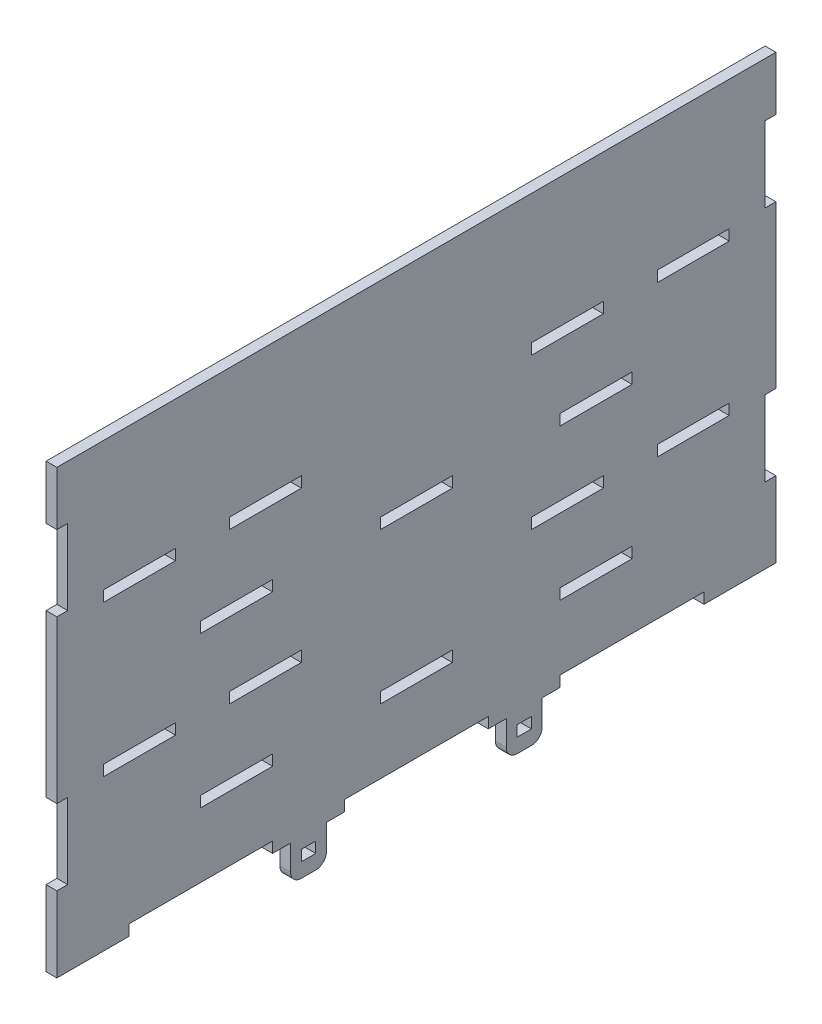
SolidWorks part; units mm, degrees
ref_plane "Front Plane" through (0, 0, 0) normal (0, 0, 1) x (1, 0, 0)
ref_plane "Top Plane" through (0, 0, 0) normal (0, 1, 0) x (1, 0, 0)
ref_plane "Right Plane" through (0, 0, 0) normal (1, 0, 0) x (0, 0, -1)
sketch "草图1" plane through (0, 0, 0) normal (1, 0, 0) x (0, 0, -1)
  line L0 (-100, 60) -> (100, 60)
  line L1 (100, 60) -> (100, -60)
  line L2 (100, -60) -> (-100, -60)
  line L3 (-100, -60) -> (-100, 60)
  point P4 (-100, 0)
  point P6 (0, 60)
  dimension "D1" = 200
  dimension "D2" = 120
extrude "凸台-拉伸1" add sketch "草图1" along normal blind 3
sketch "草图2" plane through (3, 0, 0) normal (1, 0, 0) x (0, 0, -1)
  line L0 (-100, -60) -> (-100, -63)
  line L1 (-100, -63) -> (-80, -63)
  line L2 (-80, -63) -> (-80, -60)
  line L3 (-100, -60) -> (100, -60) construction
  line L4 (-80, -60) -> (-100, -60)
  line L5 (-40, -60) -> (-40, -63)
  line L6 (-40, -63) -> (-20, -63)
  line L7 (-20, -63) -> (-20, -60)
  line L8 (-20, -60) -> (-40, -60)
  line L9 (20, -60) -> (20, -63)
  line L10 (20, -63) -> (40, -63)
  line L11 (40, -63) -> (40, -60)
  line L12 (40, -60) -> (20, -60)
  line L13 (80, -60) -> (80, -63)
  line L14 (80, -63) -> (100, -63)
  line L15 (100, -63) -> (100, -60)
  line L16 (100, -60) -> (80, -60)
  line L22 (100, -60) -> (100, 60) construction
  dimension "D1" = 3
  dimension "D2" = 3
  dimension "D3" = 3
  dimension "D4" = 3
  dimension "D5" = 0
  dimension "D6" = 20
  dimension "D7" = 40
  dimension "D8" = 20
  dimension "D9" = 40
  dimension "D10" = 20
  dimension "D12" = 20
extrude "凸台-拉伸3" add sketch "草图2" against normal blind 3
sketch "草图5" plane through (3, 0, 0) normal (1, 0, 0) x (0, 0, -1)
  line L0 (-100, -42) -> (100, -42) construction
  line L1 (-100, 60) -> (-100, -63) construction
  line L2 (100, -63) -> (100, 60) construction
  line L3 (-100, -21) -> (100, -21) construction
  line L4 (-100, 0) -> (100, 0) construction
  line L5 (-80, -60) -> (-40, -60) construction
  line L6 (-60, -42) -> (-60, -39)
  line L7 (-60, -39) -> (-40, -39)
  line L8 (-40, -39) -> (-40, -42)
  line L9 (-40, -42) -> (-60, -42)
  line L10 (0, 60) -> (0, -60) construction
  line L11 (100, 60) -> (-100, 60) construction
  line L12 (-20, -60) -> (20, -60) construction
  line L13 (-10, -42) -> (-10, -39)
  line L14 (-10, -39) -> (10, -39)
  line L15 (10, -39) -> (10, -42)
  line L16 (10, -42) -> (-10, -42)
  line L17 (40, -39) -> (40, -42)
  line L18 (60, -42) -> (60, -39)
  line L19 (60, -39) -> (40, -39)
  line L20 (40, -42) -> (60, -42)
  line L21 (-10, 3) -> (10, 3)
  line L22 (-40, 0) -> (-60, 0)
  line L23 (10, 3) -> (10, 0)
  line L24 (10, 0) -> (-10, 0)
  line L25 (-10, 0) -> (-10, 3)
  line L26 (40, 0) -> (60, 0)
  line L27 (-60, 0) -> (-60, 3)
  line L28 (-60, 3) -> (-40, 3)
  line L29 (40, 3) -> (40, 0)
  line L30 (60, 0) -> (60, 3)
  line L31 (60, 3) -> (40, 3)
  line L32 (-40, 3) -> (-40, 0)
  line L33 (-100, -42) -> (-97, -42)
  line L34 (-97, -42) -> (-97, -21)
  line L35 (-97, -21) -> (-100, -21)
  line L38 (-97, 45) -> (-100, 45)
  line L40 (-100, -21) -> (-100, -42)
  line L41 (-87, -21) -> (-87, -18)
  line L42 (-87, -18) -> (-67, -18)
  line L43 (-67, -18) -> (-67, -21)
  line L44 (-67, -21) -> (-87, -21)
  line L45 (-52, -18) -> (-52, -21)
  line L46 (-52, -21) -> (-32, -21)
  line L47 (-32, -21) -> (-32, -18)
  line L48 (-32, -18) -> (-52, -18)
  line L49 (97, 45) -> (100, 45)
  line L53 (97, -21) -> (100, -21)
  line L54 (97, -42) -> (97, -21)
  line L55 (100, -42) -> (97, -42)
  line L56 (100, -21) -> (100, -42)
  line L57 (32, -21) -> (32, -18)
  line L58 (52, -21) -> (32, -21)
  line L59 (52, -18) -> (52, -21)
  line L60 (32, -18) -> (52, -18)
  line L61 (67, -18) -> (67, -21)
  line L62 (87, -18) -> (67, -18)
  line L63 (87, -21) -> (87, -18)
  line L64 (67, -21) -> (87, -21)
  line L65 (52, 24) -> (52, 21)
  line L66 (-67, 21) -> (-87, 21)
  line L67 (87, 21) -> (87, 24)
  line L68 (-32, 21) -> (-32, 24)
  line L69 (-52, 24) -> (-52, 21)
  line L70 (52, 21) -> (32, 21)
  line L71 (67, 24) -> (67, 21)
  line L72 (-87, 24) -> (-67, 24)
  line L73 (-32, 24) -> (-52, 24)
  line L74 (32, 21) -> (32, 24)
  line L75 (-87, 21) -> (-87, 24)
  line L76 (-52, 21) -> (-32, 21)
  line L77 (32, 24) -> (52, 24)
  line L78 (87, 24) -> (67, 24)
  line L79 (67, 21) -> (87, 21)
  line L80 (-67, 24) -> (-67, 21)
  line L85 (-100, 21) -> (100, 21) construction
  line L89 (-100, 45) -> (-100, 24)
  line L90 (-100, 24) -> (-97, 24)
  line L91 (-97, 24) -> (-97, 45)
  line L92 (97, 45) -> (97, 24)
  line L93 (97, 24) -> (100, 24)
  line L94 (100, 24) -> (100, 45)
  point P92 (0, 3)
  dimension "D1" = 18
  dimension "D2" = 21
  dimension "D3" = 21
  dimension "D4" = 20
  dimension "D5" = 40
  dimension "D6" = 3
  dimension "D7" = 3
  dimension "D8" = 20
  dimension "D9" = 30
  dimension "D10" = 3
  dimension "D11" = 30
  dimension "D12" = 3
  dimension "D13" = 3
  dimension "D14" = 3
  dimension "D15" = 10
  dimension "D16" = 20
  dimension "D17" = 15
  dimension "D18" = 20
  dimension "D19" = 3
  dimension "D20" = 15
  dimension "D21" = 15
  dimension "D22" = 3
  dimension "D23" = 20
  dimension "D24" = 32
  dimension "D25" = 32
  dimension "D26" = 20
  dimension "D27" = 21
  dimension "D29" = 3
  dimension "D30" = 3
  dimension "D31" = 3
  dimension "D32" = 3
  dimension "D33" = 20
  dimension "D34" = 3
  dimension "D35" = 3
  dimension "D36" = 20
  dimension "D37" = 20
  dimension "D40" = 40
  dimension "D41" = 20
  dimension "D42" = 3
  dimension "D43" = 3
  dimension "D44" = 52
  dimension "D45" = 21
  dimension "D46" = 3
extrude "切除-拉伸2" cut sketch "草图5" against normal blind 3
sketch "草图6" plane through (3, 0, 0) normal (1, 0, 0) x (0, 0, -1)
  line L0 (-35, -63) -> (-35, -73)
  line L1 (-35, -73) -> (-25, -73)
  line L2 (-25, -73) -> (-25, -63)
  line L4 (-25, -63) -> (-35, -63)
  line L5 (35, -63) -> (35, -73)
  line L6 (35, -73) -> (25, -73)
  line L7 (25, -73) -> (25, -63)
  line L9 (25, -63) -> (35, -63)
  line L10 (-32, -66) -> (-32, -69)
  line L11 (-32, -69) -> (-28, -69)
  line L12 (-28, -69) -> (-28, -66)
  line L13 (-28, -66) -> (-32, -66)
  line L14 (28, -66) -> (28, -69)
  line L15 (28, -69) -> (32, -69)
  line L16 (32, -69) -> (32, -66)
  line L17 (32, -66) -> (28, -66)
  point P22 (-35, -68)
  point P23 (30, -73)
  dimension "D1" = 10
  dimension "D2" = 10
  dimension "D3" = 4
  dimension "D4" = 3
  dimension "D5" = 3
  dimension "D6" = 3
  dimension "D7" = 3
  dimension "D8" = 3
  dimension "D9" = 4
  dimension "D10" = 4
extrude "凸台-拉伸4" add sketch "草图6" against normal blind 3
fillet "圆角1" radius 3 4 edges at (1.5, -73, -35) (1.5, -73, -25) (1.5, -73, 25) (1.5, -73, 35)
